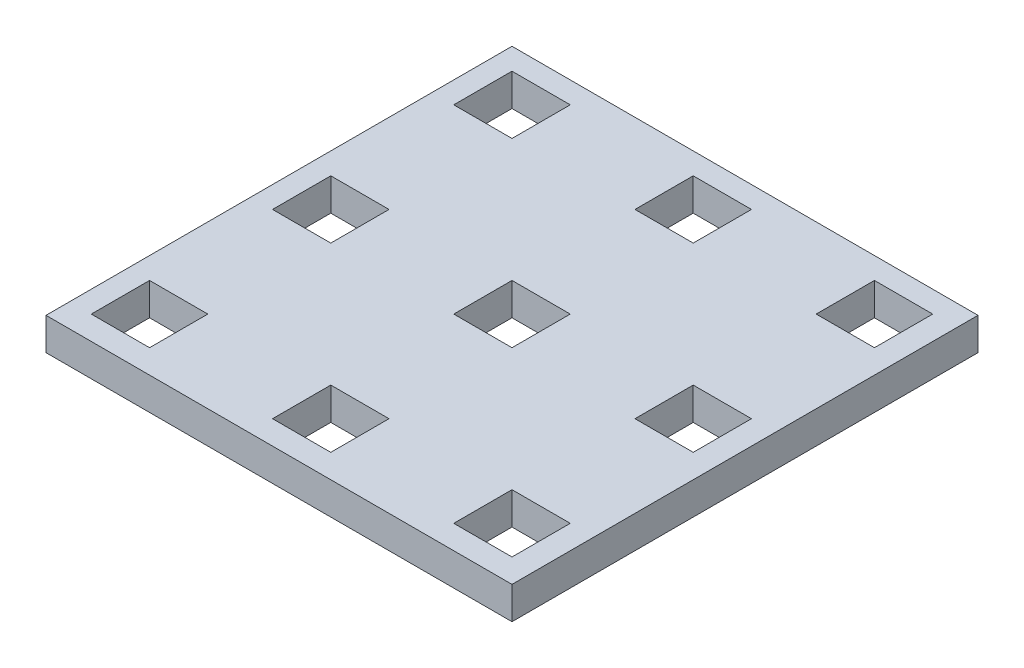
SolidWorks part; units mm, degrees
ref_plane "前视基准面" through (0, 0, 0) normal (0, 0, 1) x (1, 0, 0)
ref_plane "上视基准面" through (0, 0, 0) normal (0, 1, 0) x (1, 0, 0)
ref_plane "右视基准面" through (0, 0, 0) normal (1, 0, 0) x (0, 0, -1)
sketch "草图1" plane through (0, 0, 0) normal (0, 1, 0) x (1, 0, 0)
  line L1 (-21.6, 21.6) -> (21.6, 21.6)
  line L2 (-21.6, 21.6) -> (-21.6, -21.6)
  line L3 (-21.6, -21.6) -> (21.6, -21.6)
  line L4 (21.6, 21.6) -> (21.6, -21.6)
  line L5 (-21.6, 21.6) -> (21.6, -21.6) construction
  line L6 (-21.6, -21.6) -> (21.6, 21.6) construction
  point P0 (0, 0)
  dimension "D1" = 43.2
  dimension "D2" = 43.2
extrude "凸台-拉伸1" add sketch "草图1" along normal blind 3
sketch "草图2" plane through (0, 3, 0) normal (0, 1, 0) x (1, 0, 0)
  line L0 (21.6, 21.6) -> (-21.6, 21.6) construction
  line L1 (-19.6, 19.6) -> (-14.2, 19.6)
  line L2 (-19.6, 19.6) -> (-19.6, 14.2)
  line L3 (-19.6, 14.2) -> (-14.2, 14.2)
  line L4 (-14.2, 19.6) -> (-14.2, 14.2)
  line L5 (-19.6, 19.6) -> (-14.2, 14.2) construction
  line L6 (-19.6, 14.2) -> (-14.2, 19.6) construction
  line L7 (-21.6, 21.6) -> (-21.6, -21.6) construction
  line L8 (-2.8, 19.6) -> (2.6, 19.6)
  line L9 (2.6, 19.6) -> (2.6, 14.2)
  line L10 (-2.8, 14.2) -> (2.6, 14.2)
  line L11 (-2.8, 19.6) -> (-2.8, 14.2)
  line L12 (14, 19.6) -> (19.4, 19.6)
  line L13 (19.4, 19.6) -> (19.4, 14.2)
  line L14 (14, 14.2) -> (19.4, 14.2)
  line L15 (14, 19.6) -> (14, 14.2)
  line L32 (-2.8, 2.8) -> (2.6, 2.8)
  line L33 (2.6, 2.8) -> (2.6, -2.6)
  line L34 (-2.8, -2.6) -> (2.6, -2.6)
  line L35 (-2.8, 2.8) -> (-2.8, -2.6)
  line L36 (14, 2.8) -> (19.4, 2.8)
  line L37 (19.4, 2.8) -> (19.4, -2.6)
  line L38 (14, -2.6) -> (19.4, -2.6)
  line L39 (14, 2.8) -> (14, -2.6)
  line L56 (-2.8, -14) -> (2.6, -14)
  line L57 (2.6, -14) -> (2.6, -19.4)
  line L58 (-2.8, -19.4) -> (2.6, -19.4)
  line L59 (-2.8, -14) -> (-2.8, -19.4)
  line L60 (14, -14) -> (19.4, -14)
  line L61 (19.4, -14) -> (19.4, -19.4)
  line L62 (14, -19.4) -> (19.4, -19.4)
  line L63 (14, -14) -> (14, -19.4)
  line L176 (-19.6, 2.8) -> (-14.2, 2.8)
  line L177 (-14.2, 2.8) -> (-14.2, -2.6)
  line L178 (-19.6, -2.6) -> (-14.2, -2.6)
  line L179 (-19.6, 2.8) -> (-19.6, -2.6)
  line L180 (-19.6, -14) -> (-14.2, -14)
  line L181 (-14.2, -14) -> (-14.2, -19.4)
  line L182 (-19.6, -19.4) -> (-14.2, -19.4)
  line L183 (-19.6, -14) -> (-19.6, -19.4)
  line L200 (81.2, 19.6) -> (86.6, 19.6)
  line L201 (86.6, 19.6) -> (86.6, 14.2)
  line L202 (81.2, 14.2) -> (86.6, 14.2)
  line L203 (81.2, 19.6) -> (81.2, 14.2)
  line L204 (81.2, 2.8) -> (86.6, 2.8)
  line L205 (86.6, 2.8) -> (86.6, -2.6)
  line L206 (81.2, -2.6) -> (86.6, -2.6)
  line L207 (81.2, 2.8) -> (81.2, -2.6)
  line L208 (81.2, -14) -> (86.6, -14)
  line L209 (86.6, -14) -> (86.6, -19.4)
  line L210 (81.2, -19.4) -> (86.6, -19.4)
  line L211 (81.2, -14) -> (81.2, -19.4)
  line L212 (81.2, -30.8) -> (86.6, -30.8)
  line L213 (86.6, -30.8) -> (86.6, -36.2)
  line L214 (81.2, -36.2) -> (86.6, -36.2)
  line L215 (81.2, -30.8) -> (81.2, -36.2)
  line L216 (81.2, -47.6) -> (86.6, -47.6)
  line L217 (86.6, -47.6) -> (86.6, -53)
  line L218 (81.2, -53) -> (86.6, -53)
  line L219 (81.2, -47.6) -> (81.2, -53)
  line L220 (81.2, -64.4) -> (86.6, -64.4)
  line L221 (86.6, -64.4) -> (86.6, -69.8)
  line L222 (81.2, -69.8) -> (86.6, -69.8)
  line L223 (81.2, -64.4) -> (81.2, -69.8)
  line L224 (81.2, -81.2) -> (86.6, -81.2)
  line L225 (86.6, -81.2) -> (86.6, -86.6)
  line L226 (81.2, -86.6) -> (86.6, -86.6)
  line L227 (81.2, -81.2) -> (81.2, -86.6)
  line L228 (-2.8, -81.2) -> (2.6, -81.2)
  line L229 (2.6, -81.2) -> (2.6, -86.6)
  line L230 (-2.8, -86.6) -> (2.6, -86.6)
  line L231 (-2.8, -81.2) -> (-2.8, -86.6)
  line L232 (14, -81.2) -> (19.4, -81.2)
  line L233 (19.4, -81.2) -> (19.4, -86.6)
  line L234 (14, -86.6) -> (19.4, -86.6)
  line L235 (14, -81.2) -> (14, -86.6)
  line L236 (30.8, -81.2) -> (36.2, -81.2)
  line L237 (36.2, -81.2) -> (36.2, -86.6)
  line L238 (30.8, -86.6) -> (36.2, -86.6)
  line L239 (30.8, -81.2) -> (30.8, -86.6)
  line L240 (47.6, -81.2) -> (53, -81.2)
  line L241 (53, -81.2) -> (53, -86.6)
  line L242 (47.6, -86.6) -> (53, -86.6)
  line L243 (47.6, -81.2) -> (47.6, -86.6)
  line L244 (64.4, -81.2) -> (69.8, -81.2)
  line L245 (69.8, -81.2) -> (69.8, -86.6)
  line L246 (64.4, -86.6) -> (69.8, -86.6)
  line L247 (64.4, -81.2) -> (64.4, -86.6)
  line L248 (-19.6, -81.2) -> (-14.2, -81.2)
  line L249 (-14.2, -81.2) -> (-14.2, -86.6)
  line L250 (-19.6, -86.6) -> (-14.2, -86.6)
  line L251 (-19.6, -81.2) -> (-19.6, -86.6)
  line L252 (30.8, 19.6) -> (36.2, 19.6)
  line L253 (36.2, 19.6) -> (36.2, 14.2)
  line L254 (30.8, 14.2) -> (36.2, 14.2)
  line L255 (30.8, 19.6) -> (30.8, 14.2)
  line L256 (47.6, 19.6) -> (53, 19.6)
  line L257 (53, 19.6) -> (53, 14.2)
  line L258 (47.6, 14.2) -> (53, 14.2)
  line L259 (47.6, 19.6) -> (47.6, 14.2)
  line L260 (64.4, 19.6) -> (69.8, 19.6)
  line L261 (69.8, 19.6) -> (69.8, 14.2)
  line L262 (64.4, 14.2) -> (69.8, 14.2)
  line L263 (64.4, 19.6) -> (64.4, 14.2)
  line L264 (30.8, 2.8) -> (36.2, 2.8)
  line L265 (36.2, 2.8) -> (36.2, -2.6)
  line L266 (30.8, -2.6) -> (36.2, -2.6)
  line L267 (30.8, 2.8) -> (30.8, -2.6)
  line L268 (47.6, 2.8) -> (53, 2.8)
  line L269 (53, 2.8) -> (53, -2.6)
  line L270 (47.6, -2.6) -> (53, -2.6)
  line L271 (47.6, 2.8) -> (47.6, -2.6)
  line L272 (64.4, 2.8) -> (69.8, 2.8)
  line L273 (69.8, 2.8) -> (69.8, -2.6)
  line L274 (64.4, -2.6) -> (69.8, -2.6)
  line L275 (64.4, 2.8) -> (64.4, -2.6)
  line L276 (30.8, -14) -> (36.2, -14)
  line L277 (36.2, -14) -> (36.2, -19.4)
  line L278 (30.8, -19.4) -> (36.2, -19.4)
  line L279 (30.8, -14) -> (30.8, -19.4)
  line L280 (47.6, -14) -> (53, -14)
  line L281 (53, -14) -> (53, -19.4)
  line L282 (47.6, -19.4) -> (53, -19.4)
  line L283 (47.6, -14) -> (47.6, -19.4)
  line L284 (64.4, -14) -> (69.8, -14)
  line L285 (69.8, -14) -> (69.8, -19.4)
  line L286 (64.4, -19.4) -> (69.8, -19.4)
  line L287 (64.4, -14) -> (64.4, -19.4)
  line L288 (-2.8, -30.8) -> (2.6, -30.8)
  line L289 (2.6, -30.8) -> (2.6, -36.2)
  line L290 (-2.8, -36.2) -> (2.6, -36.2)
  line L291 (-2.8, -30.8) -> (-2.8, -36.2)
  line L292 (14, -30.8) -> (19.4, -30.8)
  line L293 (19.4, -30.8) -> (19.4, -36.2)
  line L294 (14, -36.2) -> (19.4, -36.2)
  line L295 (14, -30.8) -> (14, -36.2)
  line L296 (30.8, -30.8) -> (36.2, -30.8)
  line L297 (36.2, -30.8) -> (36.2, -36.2)
  line L298 (30.8, -36.2) -> (36.2, -36.2)
  line L299 (30.8, -30.8) -> (30.8, -36.2)
  line L300 (47.6, -30.8) -> (53, -30.8)
  line L301 (53, -30.8) -> (53, -36.2)
  line L302 (47.6, -36.2) -> (53, -36.2)
  line L303 (47.6, -30.8) -> (47.6, -36.2)
  line L304 (64.4, -30.8) -> (69.8, -30.8)
  line L305 (69.8, -30.8) -> (69.8, -36.2)
  line L306 (64.4, -36.2) -> (69.8, -36.2)
  line L307 (64.4, -30.8) -> (64.4, -36.2)
  line L308 (-2.8, -47.6) -> (2.6, -47.6)
  line L309 (2.6, -47.6) -> (2.6, -53)
  line L310 (-2.8, -53) -> (2.6, -53)
  line L311 (-2.8, -47.6) -> (-2.8, -53)
  line L312 (14, -47.6) -> (19.4, -47.6)
  line L313 (19.4, -47.6) -> (19.4, -53)
  line L314 (14, -53) -> (19.4, -53)
  line L315 (14, -47.6) -> (14, -53)
  line L316 (30.8, -47.6) -> (36.2, -47.6)
  line L317 (36.2, -47.6) -> (36.2, -53)
  line L318 (30.8, -53) -> (36.2, -53)
  line L319 (30.8, -47.6) -> (30.8, -53)
  line L320 (47.6, -47.6) -> (53, -47.6)
  line L321 (53, -47.6) -> (53, -53)
  line L322 (47.6, -53) -> (53, -53)
  line L323 (47.6, -47.6) -> (47.6, -53)
  line L324 (64.4, -47.6) -> (69.8, -47.6)
  line L325 (69.8, -47.6) -> (69.8, -53)
  line L326 (64.4, -53) -> (69.8, -53)
  line L327 (64.4, -47.6) -> (64.4, -53)
  line L328 (-2.8, -64.4) -> (2.6, -64.4)
  line L329 (2.6, -64.4) -> (2.6, -69.8)
  line L330 (-2.8, -69.8) -> (2.6, -69.8)
  line L331 (-2.8, -64.4) -> (-2.8, -69.8)
  line L332 (14, -64.4) -> (19.4, -64.4)
  line L333 (19.4, -64.4) -> (19.4, -69.8)
  line L334 (14, -69.8) -> (19.4, -69.8)
  line L335 (14, -64.4) -> (14, -69.8)
  line L336 (30.8, -64.4) -> (36.2, -64.4)
  line L337 (36.2, -64.4) -> (36.2, -69.8)
  line L338 (30.8, -69.8) -> (36.2, -69.8)
  line L339 (30.8, -64.4) -> (30.8, -69.8)
  line L340 (47.6, -64.4) -> (53, -64.4)
  line L341 (53, -64.4) -> (53, -69.8)
  line L342 (47.6, -69.8) -> (53, -69.8)
  line L343 (47.6, -64.4) -> (47.6, -69.8)
  line L344 (64.4, -64.4) -> (69.8, -64.4)
  line L345 (69.8, -64.4) -> (69.8, -69.8)
  line L346 (64.4, -69.8) -> (69.8, -69.8)
  line L347 (64.4, -64.4) -> (64.4, -69.8)
  line L348 (-19.6, -30.8) -> (-14.2, -30.8)
  line L349 (-14.2, -30.8) -> (-14.2, -36.2)
  line L350 (-19.6, -36.2) -> (-14.2, -36.2)
  line L351 (-19.6, -30.8) -> (-19.6, -36.2)
  line L352 (-19.6, -47.6) -> (-14.2, -47.6)
  line L353 (-14.2, -47.6) -> (-14.2, -53)
  line L354 (-19.6, -53) -> (-14.2, -53)
  line L355 (-19.6, -47.6) -> (-19.6, -53)
  line L356 (-19.6, -64.4) -> (-14.2, -64.4)
  line L357 (-14.2, -64.4) -> (-14.2, -69.8)
  line L358 (-19.6, -69.8) -> (-14.2, -69.8)
  line L359 (-19.6, -64.4) -> (-19.6, -69.8)
  point P0 (-16.9, 16.9)
  dimension "D1" = 5.4
  dimension "D2" = 5.4
  dimension "D3" = 2
  dimension "D4" = 2
  dimension "D7" = 16.8
  dimension "D8" = 16.8
  dimension "D5" = 7
  dimension "D6" = 7
extrude "切除-拉伸1" cut sketch "草图2" against normal through all
